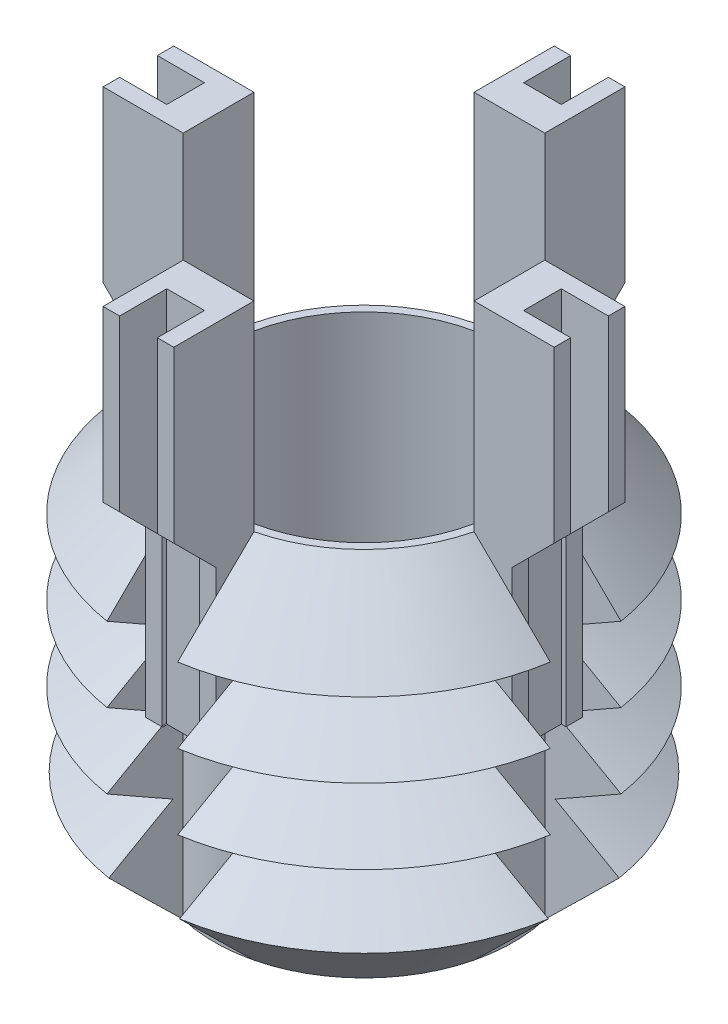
SolidWorks part; units mm, degrees
ref_plane "Front Plane" through (0, 0, 0) normal (0, 0, 1) x (1, 0, 0)
ref_plane "Top Plane" through (0, 0, 0) normal (0, 1, 0) x (1, 0, 0)
ref_plane "Right Plane" through (0, 0, 0) normal (1, 0, 0) x (0, 0, -1)
sketch "Sketch1" plane through (0, 0, 0) normal (0, 1, 0) x (1, 0, 0)
  circle A0 centre (0, 0) radius 4.7625
  dimension "D1" = 9.525
extrude "Boss-Extrude1" add sketch "Sketch1" against normal blind 7.874
chamfer "Chamfer1" distance 1.587 angle 45 2 edges at (0, -7.874, 4.7625) (0, 0, 4.7625)
sketch "Sketch2" plane through (0, 0, 0) normal (1, 0, 0) x (0, 0, -1)
  line L0 (0, 0.8859) -> (0, -9.2617) construction
sketch "Sketch3" plane through (0, 0, 0) normal (1, 0, 0) x (0, 0, -1)
  line L0 (-4.7625, -1.587) -> (-3.3881, -2.3805)
  line L1 (-3.3881, -2.3805) -> (-4.7625, -3.174)
  line L2 (-4.7625, -1.587) -> (-4.7625, -6.287) construction
  line L3 (-4.7625, -3.174) -> (-4.7625, -1.587)
  dimension "D1" = 1.587
revolve "Cut-Revolve1" cut sketch "Sketch3" angle 360 about L0
pattern_linear "LPattern1" count 3 spacing 1.587 along (0, -1, 0) of "Cut-Revolve1"
sketch "Sketch4" plane through (0, 0, 0) normal (0, 1, 0) x (1, 0, 0)
  line L0 (-3.0857, 0.75) -> (-4.7031, 0.75)
  line L2 (-4.7031, -0.75) -> (-3.0857, -0.75)
  arc A0 (-3.0857, 0.75) -> (-3.0857, -0.75) centre (0, 0) ccw
  arc A1 (-4.7031, 0.75) -> (-4.7031, -0.75) centre (0, 0) ccw
  circle A2 centre (0, 0) radius 4.7625 construction
  circle A3 centre (0, 0) radius 3.1755 construction
  point P1 (-3.1755, 0)
  point P3 (-4.7625, 0)
  point P13 (0, 0)
  dimension "D1" = 1.5
extrude "Cut-Extrude1" cut sketch "Sketch4" against normal up to surface (7.874 mm away)
pattern_circular "CirPattern1" count 4 over 360 about axis through (0, 0, 0) along (0, 1, 0) of "Cut-Extrude1"
sketch "Sketch5" plane through (0, 0, 0) normal (1, 0, 0) x (0, 0, -1)
  line L0 (-3.0857, 4.239) -> (-3.0857, -3.761)
  line L1 (-3.0857, -3.761) -> (-3.8857, -3.761)
  line L2 (-3.8857, -3.761) -> (-3.8857, -0.261)
  line L3 (-3.8857, -0.261) -> (-4.7857, 0.639)
  line L4 (-4.7857, 0.639) -> (-4.7857, 4.239)
  line L5 (-4.7857, 4.239) -> (-3.0857, 4.239)
  line L6 (-4.7031, -4.761) -> (-0.75, -4.761) construction
  point P9 (-0.75, 0)
  point P10 (-3.8857, -0.261)
  dimension "D1" = 1
  dimension "D2" = 8
  dimension "D3" = 4.5
  dimension "D4" = 1.7
  dimension "D5" = 0.8
  dimension "D6" = 45
extrude "Boss-Extrude3" add sketch "Sketch5" along normal mid plane 1.5
pattern_circular "CirPattern2" count 4 over 360 about axis through (0, 0, 0) along (0, 1, 0) of "Boss-Extrude3"
sketch "Sketch6" plane through (0, 4.239, 0) normal (0, 1, 0) x (1, 0, 0)
  line L0 (-4.7857, -0.75) -> (-4.7857, 0.75) construction
  line L1 (-4.7857, -0.4) -> (-3.7857, -0.4)
  line L2 (-4.7857, -0.4) -> (-4.7857, 0.4)
  line L3 (-4.7857, 0.4) -> (-3.7857, 0.4)
  line L4 (-3.7857, -0.4) -> (-3.7857, 0.4)
  line L5 (-4.7857, -0.4) -> (-3.7857, 0.4) construction
  line L6 (-4.7857, 0.4) -> (-3.7857, -0.4) construction
  line L7 (4.7857, 0.75) -> (4.7857, -0.75) construction
  line L8 (-0.4, 3.7857) -> (0.4, 3.7857)
  line L9 (-0.4, 3.7857) -> (-0.4, 4.7857)
  line L10 (-0.4, 4.7857) -> (0.4, 4.7857)
  line L11 (0.4, 3.7857) -> (0.4, 4.7857)
  line L12 (-0.4, 3.7857) -> (0.4, 4.7857) construction
  line L13 (-0.4, 4.7857) -> (0.4, 3.7857) construction
  line L14 (3.7857, -0.4) -> (4.7857, -0.4)
  line L15 (3.7857, -0.4) -> (3.7857, 0.4)
  line L16 (3.7857, 0.4) -> (4.7857, 0.4)
  line L17 (4.7857, -0.4) -> (4.7857, 0.4)
  line L18 (3.7857, -0.4) -> (4.7857, 0.4) construction
  line L19 (3.7857, 0.4) -> (4.7857, -0.4) construction
  line L20 (-0.4, -4.7857) -> (0.4, -4.7857)
  line L21 (-0.4, -4.7857) -> (-0.4, -3.7857)
  line L22 (-0.4, -3.7857) -> (0.4, -3.7857)
  line L23 (0.4, -4.7857) -> (0.4, -3.7857)
  line L24 (-0.4, -4.7857) -> (0.4, -3.7857) construction
  line L25 (-0.4, -3.7857) -> (0.4, -4.7857) construction
  line L26 (-0.75, 4.7857) -> (0.75, 4.7857) construction
  line L27 (0.75, -4.7857) -> (-0.75, -4.7857) construction
  point P0 (-4.2857, 0)
  point P7 (-4.7857, 0)
  point P8 (-4.7857, 0)
  point P9 (0, 4.2857)
  point P14 (4.2857, 0)
  point P19 (0, -4.2857)
  point P24 (0, 4.7857)
  point P25 (4.7857, 0)
  point P26 (4.7857, 0)
  point P27 (0, 4.7857)
  point P30 (0, -4.7857)
  point P33 (0, -4.7857)
  dimension "D1" = 0.8
  dimension "D2" = 1
extrude "Cut-Extrude3" cut sketch "Sketch6" against normal up to surface (3.6 mm away)
sketch "Sketch7" plane through (0, 0, 0) normal (0, 1, 0) x (1, 0, 0)
  circle A0 centre (0, 0) radius 3
  dimension "D1" = 6
extrude "Cut-Extrude4" cut sketch "Sketch7" against normal up to surface (7.874 mm away)
